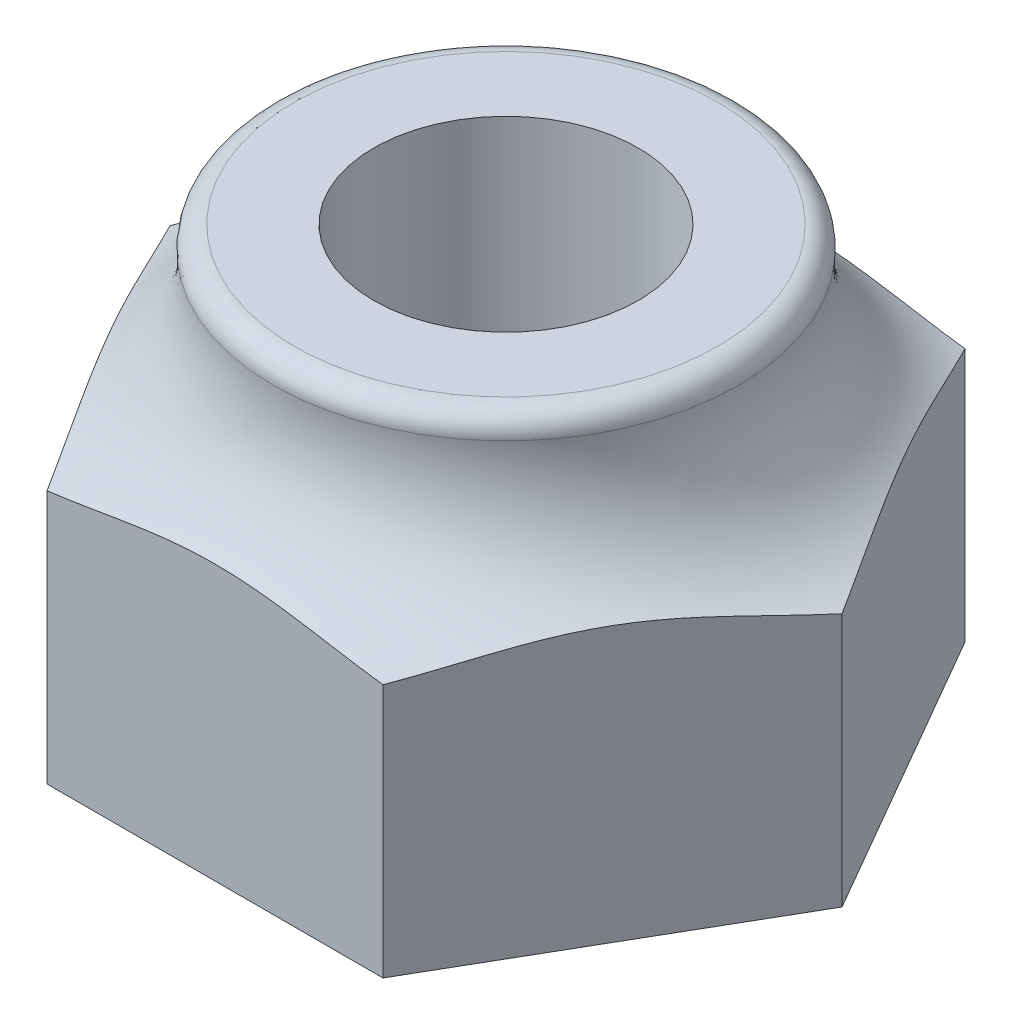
SolidWorks part; units mm, degrees
ref_plane "Aufriss" through (0, 0, 0) normal (0, 0, 1) x (1, 0, 0)
ref_plane "Grundriss" through (0, 0, 0) normal (0, 1, 0) x (1, 0, 0)
ref_plane "Seitenriss" through (0, 0, 0) normal (1, 0, 0) x (0, 0, -1)
sketch "Skizze1" plane through (0, 0, 0) normal (0, 1, 0) x (1, 0, 0)
  line L1 (1.5877, 2.75) -> (-1.5877, 2.75)
  line L2 (-1.5877, 2.75) -> (-3.1754, 0)
  line L3 (-3.1754, 0) -> (-1.5877, -2.75)
  line L4 (-1.5877, -2.75) -> (1.5877, -2.75)
  line L5 (1.5877, -2.75) -> (3.1754, 0)
  line L6 (3.1754, 0) -> (1.5877, 2.75)
  circle A0 centre (0, 0) radius 2.75 construction
  dimension "D1" = 5.5
extrude "Aufsatz-Linear austragen1" add sketch "Skizze1" along normal blind 4
sketch "Skizze2" plane through (0, 0, 0) normal (0, 0, 1) x (1, 0, 0)
  line L1 (-3.1754, 4) -> (-1.5877, 4) construction
  line L2 (-2, 4) -> (-3.1754, 4)
  line L3 (-3.1754, 4) -> (-3.1754, 2.4)
  line L5 (0, 0) -> (0, 4) construction
  line L6 (-3.1754, 4) -> (-3.1754, 0) construction
  line L7 (-3.1754, 0) -> (-1.5877, 0) construction
  arc A0 (-3.1754, 2.4) -> (-2.1991, 3.7814) centre (-3.4935, 3.6605) ccw
  arc A1 (-2, 4) -> (-2.1991, 3.7814) centre (-2, 3.8) ccw
  dimension "D1" = 1.3
  dimension "D2" = 0.2
  dimension "D3" = 4
  dimension "D4" = 2.4
revolve "Schnitt-Rotation1" cut sketch "Skizze2" angle 360 about L5
hole_wizard "Ø1.0 (1) Durchmesser Bohrung1" positions "Skizze4" profile "Skizze3" hole size "Ø1.0" standard "DIN"
sketch "Skizze4" plane through (0, 4, 0) normal (0, 1, 0) x (1, 0, 0)
  point P0 (0, 0)
sketch "Skizze3" plane through (0, 4, 0) normal (1, 0, 0) x (0, 0, 1)
  line L0 (0, 0) -> (0, 4)
  line L1 (0, 4) -> (1.25, 4)
  line L2 (1.25, 4) -> (1.25, 0)
  line L5 (1.25, 0) -> (0, 0)
  line L11 (0, -6.35) -> (0, 107.95) construction
  dimension "Bohrerdurchmesser" = 2.5
  dimension "Bohrungstiefe" = 4
